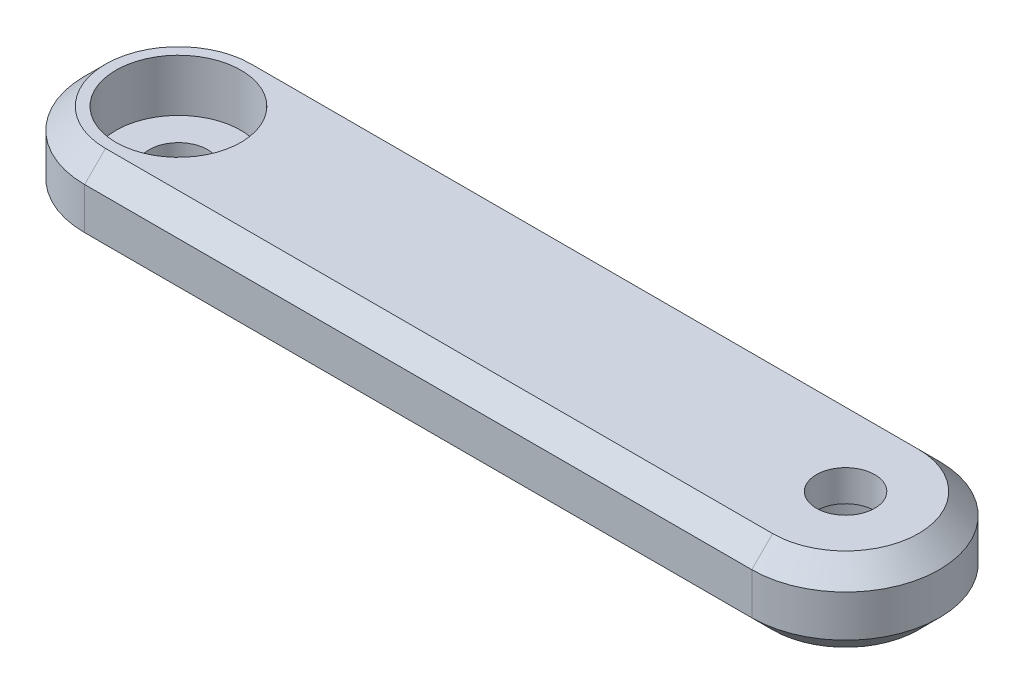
SolidWorks part; units mm, degrees
ref_plane "Front Plane" through (0, 0, 0) normal (0, 0, 1) x (1, 0, 0)
ref_plane "Top Plane" through (0, 0, 0) normal (0, 1, 0) x (1, 0, 0)
ref_plane "Right Plane" through (0, 0, 0) normal (1, 0, 0) x (0, 0, -1)
sketch "草图1" plane through (0, 0, 0) normal (0, 1, 0) x (1, 0, 0)
  line L1 (-15.6633, 5.8053) -> (11.3367, 5.8053)
  line L3 (-15.6633, -3.1947) -> (11.3367, -3.1947)
  line L4 (11.3367, 5.8053) -> (16.3367, 5.8053)
  line L6 (11.3367, -3.1947) -> (16.3367, -3.1947)
  arc A1 (-15.6633, 5.8053) -> (-15.6633, -3.1947) centre (-15.6633, 1.3053) ccw
  arc A2 (16.3367, -3.1947) -> (16.3367, 5.8053) centre (16.3367, 1.3053) ccw
  dimension "D3" = 5
  dimension "D1" = 27
  dimension "D2" = 9
extrude "凸台-拉伸1" add sketch "草图1" along normal blind 4
sketch "草图2" plane through (0, 4, 0) normal (0, 1, 0) x (1, 0, 0)
  line L0 (0.3367, 5.8053) -> (0.3367, -3.1947)
  line L1 (16.3367, 5.8053) -> (-15.6633, 5.8053) construction
  line L2 (-15.6633, -3.1947) -> (16.3367, -3.1947) construction
  circle A0 centre (-15.6633, 1.3053) radius 1.4
  circle A2 centre (16.3367, 1.3053) radius 1.4
extrude "切除-拉伸4" cut sketch "草图2" against normal blind 10 contours A2 | A0
chamfer "倒角1" distance 1 angle 45 8 edges at (0.3367, 4, 3.1947) (0.3367, 4, -5.8053) (-20.1633, 4, -1.3053) (-20.1633, 0, -1.3053) (0.3367, 0, 3.1947) (0.3367, 0, -5.8053) (20.8367, 4, -1.3053) (20.8367, 0, -1.3053)
sketch "草图5" plane through (0, 0, 0) normal (0, -1, 0) x (1, 0, 0)
  circle A0 centre (16.3367, -1.3053) radius 1.6
  circle A1 centre (16.3367, -1.3053) radius 2.25
extrude "凸台-拉伸2" add sketch "草图5" against normal up to surface (4 mm away)
sketch "草图7" plane through (0, 0, 0) normal (0, -1, 0) x (1, 0, 0)
  circle A0 centre (16.3367, -1.3053) radius 3
  circle A1 centre (16.3367, -1.3053) radius 1.4 construction
  dimension "D1" = 0
extrude "切除-拉伸6" cut sketch "草图7" against normal blind 2.5
sketch "草图8" plane through (0, 4, 0) normal (0, 1, 0) x (1, 0, 0)
  circle A0 centre (-15.6633, 1.3053) radius 3
extrude "切除-拉伸7" cut sketch "草图8" against normal blind 2.5
